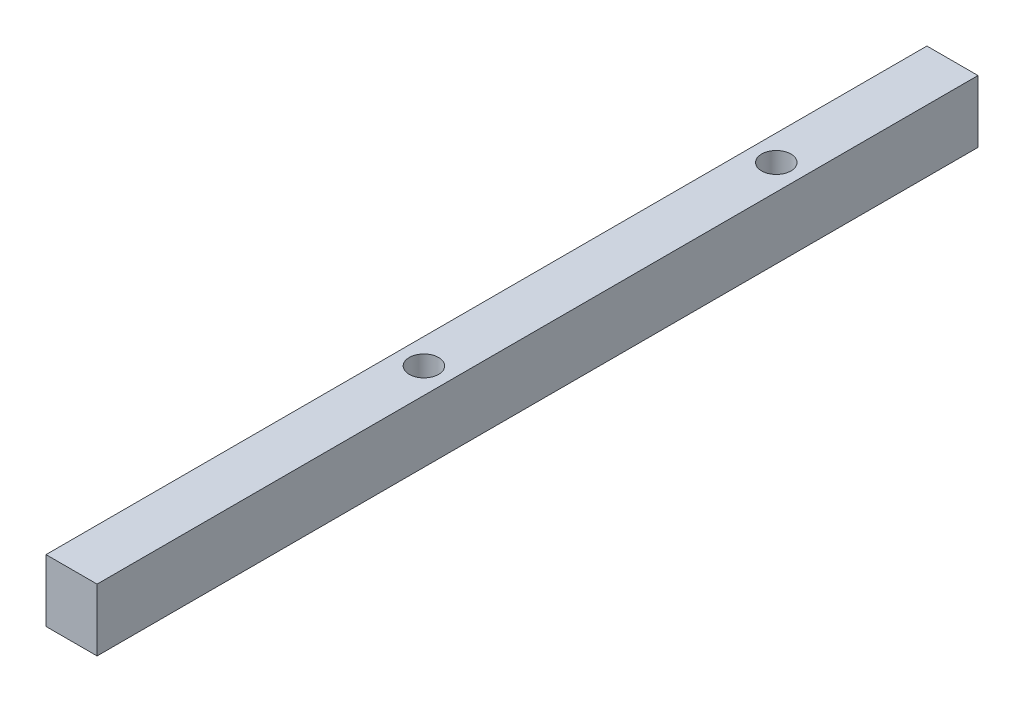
SolidWorks part; units mm, degrees
ref_plane "Piano frontale" through (0, 0, 0) normal (0, 0, 1) x (1, 0, 0)
ref_plane "Piano superiore" through (0, 0, 0) normal (0, 1, 0) x (1, 0, 0)
ref_plane "Piano destro" through (0, 0, 0) normal (1, 0, 0) x (0, 0, -1)
sketch "Sketch1" plane through (0, 0, 0) normal (0, 1, 0) x (1, 0, 0)
  line L0 (4.35, 0) -> (4.35, 60) construction
  line L1 (0, 0) -> (8.7, 0)
  line L2 (0, 0) -> (0, 150)
  line L3 (0, 150) -> (8.7, 150)
  line L4 (8.7, 0) -> (8.7, 150)
  line L5 (4.35, 60) -> (4.35, 120) construction
  circle A0 centre (4.35, 120) radius 2.5
  circle A1 centre (4.35, 60) radius 2.5
  dimension "D1" = 5
  dimension "D2" = 4.35
  dimension "D3" = 60
  dimension "D5" = 150
extrude "Boss-Extrude1" add sketch "Sketch1" along normal blind 10.6 contours L1 L4 L3 L2 A1 A0
equation "\"8.7.00mm\"=10"
